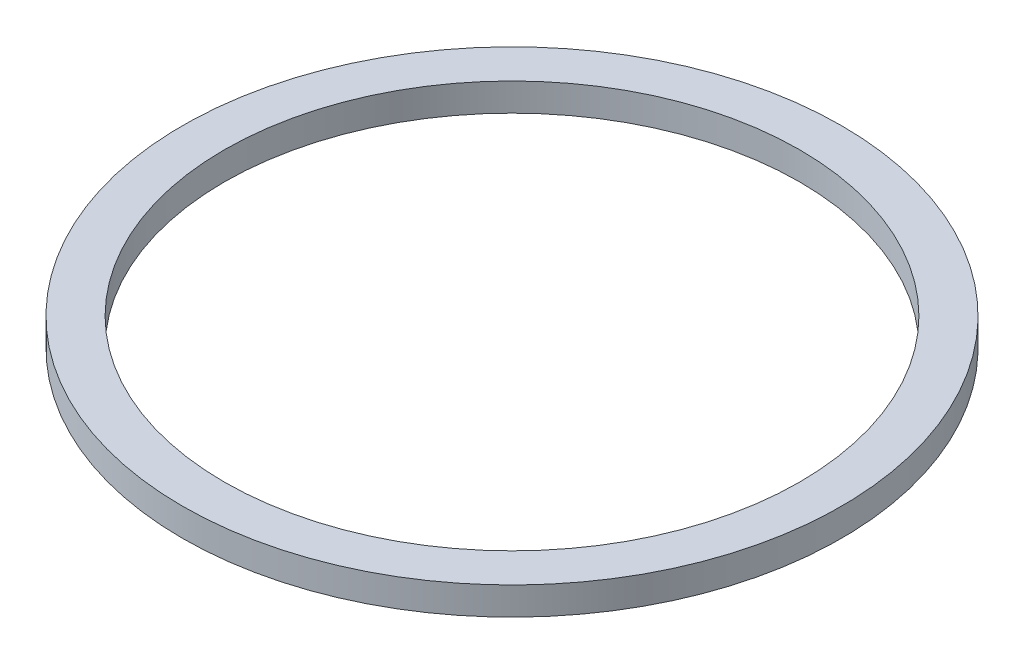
SolidWorks part; units mm, degrees
ref_plane "Piano frontale" through (0, 0, 0) normal (0, 0, 1) x (1, 0, 0)
ref_plane "Piano superiore" through (0, 0, 0) normal (0, 1, 0) x (1, 0, 0)
ref_plane "Piano destro" through (0, 0, 0) normal (1, 0, 0) x (0, 0, -1)
sketch "Schizzo1" plane through (0, 0, 0) normal (0, 1, 0) x (1, 0, 0)
  circle A0 centre (0, 0) radius 16.55
  circle A1 centre (0, 0) radius 14.45
  dimension "D1" = 2.1
  dimension "D2" = 28.9
extrude "Estrusione1" add sketch "Schizzo1" along normal blind 1.4
